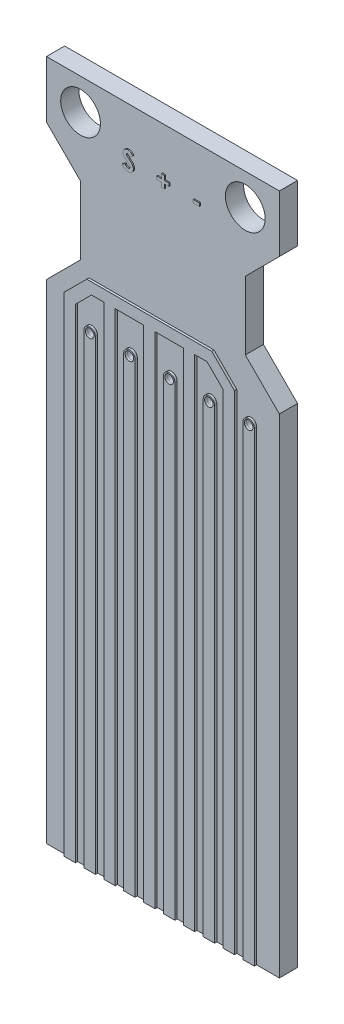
SolidWorks part; units mm, degrees
ref_plane "Plan de face" through (0, 0, 0) normal (0, 0, 1) x (1, 0, 0)
ref_plane "Plan de dessus" through (0, 0, 0) normal (0, 1, 0) x (1, 0, 0)
ref_plane "Plan de droite" through (0, 0, 0) normal (1, 0, 0) x (0, 0, -1)
sketch "Esquisse1" plane through (0, 0, 0) normal (0, 0, 1) x (1, 0, 0)
  line L0 (20.5, 55) -> (17.5, 52)
  line L1 (0, 0) -> (20.5, 0)
  line L2 (0, 0) -> (0, 43)
  line L3 (0, 60) -> (20.5, 60)
  line L4 (20.5, 0) -> (20.5, 43)
  line L5 (17.5, 52) -> (17.5, 46)
  line L6 (17.5, 46) -> (20.5, 43)
  line L7 (17.5, 49) -> (25.0762, 49) construction
  line L8 (10.25, 60) -> (10.25, 38.0602) construction
  line L9 (20.5, 55) -> (20.5, 60)
  line L10 (0, 55) -> (0, 60)
  line L11 (3, 46) -> (0, 43)
  line L12 (3, 52) -> (3, 46)
  line L13 (0, 55) -> (3, 52)
  line L14 (17.5, 63.1053) -> (17.5, 54.0423) construction
  line L15 (13.0896, 57.25) -> (18.4495, 57.25) construction
  line L16 (-3.4425, 41) -> (22.9324, 41) construction
  circle A0 centre (17.5, 57.25) radius 1.75
  circle A1 centre (3, 57.25) radius 1.75
  circle A2 centre (4, 41) radius 0.4
  circle A3 centre (7.5, 41) radius 0.4
  circle A4 centre (11, 41) radius 0.4
  circle A5 centre (14.5, 41) radius 0.4
  circle A6 centre (18, 41) radius 0.4
  dimension "D9" = 41
  dimension "D10" = 4
  dimension "D1" = 20.5
  dimension "D2" = 60
  dimension "D3" = 5
  dimension "D4" = 12
  dimension "D5" = 3
  dimension "D6" = 6
  dimension "D7" = 3
  dimension "D8" = 2.75
extrude "Extrusion1" add sketch "Esquisse1" along normal blind 1.6
sketch "Esquisse2" plane through (0, 0, 1.6) normal (0, 0, 1) x (1, 0, 0)
  line L0 (0, 0) -> (20.5, 0) construction
  line L1 (7, 41) -> (7, 0)
  line L2 (3.5, 41) -> (3.5, 0)
  line L3 (3.5, 0) -> (4.5, 0)
  line L4 (4.5, 41) -> (4.5, 0)
  line L5 (7, 0) -> (8, 0)
  line L6 (8, 41) -> (8, 0)
  line L7 (10.5, 41) -> (10.5, 0)
  line L8 (10.5, 0) -> (11.5, 0)
  line L9 (11.5, 41) -> (11.5, 0)
  line L10 (14, 41) -> (14, 0)
  line L11 (14, 0) -> (15, 0)
  line L12 (15, 41) -> (15, 0)
  line L13 (17.5, 41) -> (17.5, 0)
  line L14 (17.5, 0) -> (18.5, 0)
  line L15 (18.5, 41) -> (18.5, 0)
  arc A0 (3.5, 41) -> (4.5, 41) centre (4, 41) cw
  circle A1 centre (4, 41) radius 0.4 construction
  circle A2 centre (4, 41) radius 0.3809
  arc A3 (7, 41) -> (8, 41) centre (7.5, 41) cw
  circle A4 centre (7.5, 41) radius 0.3809
  arc A5 (10.5, 41) -> (11.5, 41) centre (11, 41) cw
  circle A6 centre (11, 41) radius 0.3809
  arc A7 (14, 41) -> (15, 41) centre (14.5, 41) cw
  circle A8 centre (14.5, 41) radius 0.3809
  arc A9 (17.5, 41) -> (18.5, 41) centre (18, 41) cw
  circle A10 centre (18, 41) radius 0.3809
  dimension "D1" = 1
extrude "Extrusion2" add sketch "Esquisse2" along normal blind 0.2
sketch "Esquisse3" plane through (0, 0, 1.6) normal (0, 0, 1) x (1, 0, 0)
  line L0 (14.3358, 44) -> (13.25, 44)
  line L1 (6.25, 0) -> (5.25, 0)
  line L2 (6.25, 0) -> (6.25, 44)
  line L3 (2.75, 42.5858) -> (4.1642, 44)
  line L4 (5.25, 0) -> (5.25, 44)
  line L5 (0, 0) -> (3.5, 0) construction
  line L6 (5.75, 0) -> (5.75, 1.2227) construction
  line L7 (5.75, 0) -> (5.75, 0.4963) construction
  line L8 (4.5, 0) -> (7, 0) construction
  line L9 (-4.1001, 44) -> (26.9697, 44) construction
  line L10 (15, 0) -> (17.5, 0) construction
  line L11 (9.75, 0) -> (8.75, 0)
  line L12 (9.75, 0) -> (9.75, 44)
  line L13 (12.25, 44) -> (9.75, 44)
  line L14 (8.75, 0) -> (8.75, 44)
  line L15 (9.25, 0) -> (9.25, 1.2227) construction
  line L16 (9.25, 0) -> (9.25, 0.4963) construction
  line L17 (13.25, 0) -> (12.25, 0)
  line L18 (13.25, 0) -> (13.25, 44)
  line L19 (8.75, 44) -> (6.25, 44)
  line L20 (12.25, 0) -> (12.25, 44)
  line L21 (12.75, 0) -> (12.75, 1.2227) construction
  line L22 (12.75, 0) -> (12.75, 0.4963) construction
  line L23 (16.75, 0) -> (15.75, 0)
  line L24 (16.75, 0) -> (16.75, 43)
  line L25 (15.75, 42.5858) -> (14.3358, 44)
  line L26 (15.75, 0) -> (15.75, 42.5858)
  line L27 (16.25, 0) -> (16.25, 1.2227) construction
  line L28 (16.25, 0) -> (16.25, 0.4963) construction
  line L29 (2.75, 0) -> (1.75, 0)
  line L30 (2.75, 0) -> (2.75, 42.5858)
  line L32 (1.75, 0) -> (1.75, 43)
  line L33 (2.25, 0) -> (2.25, 1.2227) construction
  line L34 (2.25, 0) -> (2.25, 0.4963) construction
  line L35 (5.25, 44) -> (4.1642, 44)
  line L36 (14.75, 45) -> (16.75, 43)
  line L37 (3.75, 45) -> (1.75, 43)
  line L39 (3, 46) -> (0, 43) construction
  line L40 (20.5, 43) -> (17.5, 46) construction
  line L43 (3.75, 45) -> (14.75, 45)
  line L46 (6.25, 43) -> (5.25, 43)
  line L48 (16.75, 43) -> (15.75, 43)
  line L49 (13.25, 43) -> (12.25, 43)
  line L50 (9.75, 43) -> (8.75, 43)
  point P20 (0, 0)
  dimension "D1" = 1
  dimension "D2" = 44
  dimension "D3" = 1
  dimension "D5" = 1
extrude "Extrusion3" add sketch "Esquisse3" along normal blind 0.2
sketch "Esquisse4" plane through (0, 0, 1.6) normal (0, 0, 1) x (1, 0, 0)
  text T0 "<b>S   +   -</b>" font "Century Gothic" height in points 6
extrude "Extrusion4" add sketch "Esquisse4" along normal blind 0.1
